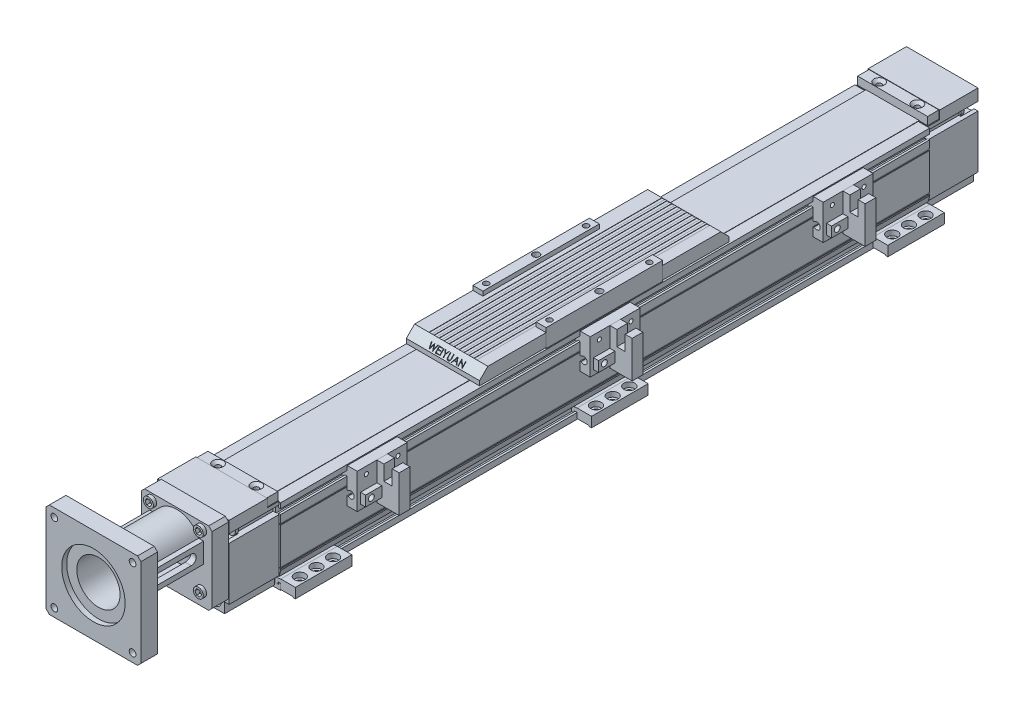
SolidWorks part; units mm, degrees
other "<感应开宽座>-<M3 螺纹孔1>"
other "<EE-SX672672P>-<凸台-拉伸3>"
other "<感应开宽座>-<M3 螺纹孔1>"
other "<EE-SX672672P>-<凸台-拉伸3>"
other "<感应开宽座>-<M3 螺纹孔1>"
other "<EE-SX672672P>-<凸台-拉伸3>"
ref_plane "前视基准面" through (0, 0, 0) normal (0, 0, 1) x (1, 0, 0)
ref_plane "上视基准面" through (0, 0, 0) normal (0, 1, 0) x (1, 0, 0)
ref_plane "右视基准面" through (0, 0, 0) normal (1, 0, 0) x (0, 0, -1)
sketch "草图1" plane through (0, 0, 0) normal (0, 0, 1) x (1, 0, 0)
  line L0 (-70.2256, 0) -> (70.2256, 0) construction
  line L1 (0, -59.1882) -> (0, 59.1882) construction
  line L2 (-22.5, -22.8) -> (-22.5, -19.3)
  line L3 (-22.5, 22.8) -> (-15, 22.8)
  line L4 (-22.5, -22.8) -> (-10, -22.8)
  line L5 (22.5, 19.7) -> (22.5, 22.8)
  line L6 (-15, 22.8) -> (-15, 21.3)
  line L7 (-15, 21.3) -> (-13, 21.3)
  line L8 (-13, 21.3) -> (-13, 22.8)
  line L9 (-12, 16.8) -> (12, 16.8)
  line L10 (-21.2, 16.7) -> (-22.5, 16.7)
  line L11 (12, 22.8) -> (12, 16.8)
  line L12 (13, 22.8) -> (12, 22.8)
  line L13 (-13, 22.8) -> (-12, 22.8)
  line L14 (-12, 22.8) -> (-12, 16.8)
  line L15 (-21.2, 16.7) -> (-21.2, 15.7)
  line L16 (-22.5, 12.2) -> (-22, 12.2)
  line L17 (-22, 12.2) -> (-22, 11.2)
  line L18 (13, 21.3) -> (13, 22.8)
  line L19 (15, 21.3) -> (13, 21.3)
  line L20 (15, 22.8) -> (15, 21.3)
  line L21 (22.5, 22.8) -> (15, 22.8)
  line L22 (-22.5, -19.3) -> (-21.2, -19.3)
  line L23 (-21.2, -19.3) -> (-21.2, -20.3)
  line L24 (-21.2, -20.3) -> (-19.3, -20.3)
  line L25 (-19.3, -20.3) -> (-19.3, -16.1)
  line L26 (-19.3, -16.1) -> (-21.5, -16.1)
  line L27 (-22.5, 19.7) -> (-21.2, 19.7)
  line L28 (-21.2, 19.7) -> (-21.2, 20.7)
  line L29 (-21.2, 20.7) -> (-19.3, 20.7)
  line L30 (-19.3, 20.7) -> (-19.3, 16.7)
  line L31 (-22, 11.2) -> (-22.5, 11.2)
  line L32 (-22.5, -12.37) -> (-22.5, -11.6)
  line L33 (-22.5, 19.7) -> (-22.5, 22.8)
  line L34 (21.2, 16.7) -> (22.5, 16.7)
  line L35 (19.3, 18.7) -> (23.7673, 18.7) construction
  line L36 (-21.2, 15.7) -> (-19.3, 15.7)
  line L37 (22.5, 12.2) -> (22.5, 16.7)
  line L38 (22, 12.2) -> (22, 11.2)
  line L39 (19.3, 20.7) -> (19.3, 16.7)
  line L40 (19.3, -18.2) -> (25.1099, -18.2) construction
  line L41 (22, 11.2) -> (22.5, 11.2)
  line L42 (22.5, -10.6) -> (22.5, 11.2)
  line L43 (22.5, -10.6) -> (22, -10.6)
  line L44 (19.3, -20.3) -> (19.3, -16.1)
  line L45 (22.5, -22.8) -> (22.5, -19.3)
  line L46 (-22.5, 12.2) -> (-22.5, 16.7)
  line L47 (-21.5, -16.1) -> (-22.5, -12.37)
  line L48 (-22.5, -10.6) -> (-22, -10.6)
  line L49 (-22, -10.6) -> (-22, -11.6)
  line L50 (-19.3, 18.7) -> (-23.7673, 18.7) construction
  line L51 (-22, -11.6) -> (-22.5, -11.6)
  line L52 (-22.5, -10.6) -> (-22.5, 11.2)
  line L53 (21.2, 20.7) -> (19.3, 20.7)
  line L54 (21.2, 19.7) -> (21.2, 20.7)
  line L55 (22.5, 19.7) -> (21.2, 19.7)
  line L56 (-19.3, -18.2) -> (-25.1099, -18.2) construction
  line L57 (22, -10.6) -> (22, -11.6)
  line L58 (22, -11.6) -> (22.5, -11.6)
  line L59 (21.2, -20.3) -> (19.3, -20.3)
  line L60 (21.2, -19.3) -> (21.2, -20.3)
  line L61 (22.5, -19.3) -> (21.2, -19.3)
  line L62 (22.5, -12.37) -> (22.5, -11.6)
  line L63 (21.5, -16.1) -> (22.5, -12.37)
  line L64 (19.3, -16.1) -> (21.5, -16.1)
  line L65 (22, 12.2) -> (22.5, 12.2)
  line L66 (10, -22.8) -> (22.5, -22.8)
  line L67 (-10, -22.3) -> (10, -22.3)
  line L68 (-10, -22.3) -> (-10, -22.8)
  line L69 (-19.3, 15.7) -> (-19.3, 16.7)
  line L70 (10, -22.3) -> (10, -22.8)
  line L71 (19.3, 16.7) -> (19.3, 15.7)
  line L72 (19.3, 15.7) -> (21.2, 15.7)
  line L73 (21.2, 15.7) -> (21.2, 16.7)
  circle A0 centre (-16, 18.2) radius 1.7
  circle A1 centre (-13, -16.8) radius 1.7
  circle A2 centre (16, 18.2) radius 1.7
  circle A3 centre (13, -16.8) radius 1.7
  point P6 (0, 0)
  point P9 (22.5, 0)
  point P11 (-22.5, 0)
  point P12 (0, -22.8)
  point P16 (0, -17.3)
  point P67 (20, 0)
  point P68 (-20, 0)
  dimension "D10" = 3.4
  dimension "D11" = 3.4
  dimension "D1" = 45
  dimension "D2" = 45.6
  dimension "D3" = 1
  dimension "D4" = 2
  dimension "D5" = 1.5
  dimension "D6" = 24
  dimension "D7" = 1
  dimension "D8" = 3
  dimension "D9" = 4.5
  dimension "D12" = 4.6
  dimension "D13" = 6
  dimension "D14" = 3.5
  dimension "D15" = 1
  dimension "D16" = 1.9
  dimension "D17" = 1.3
  dimension "D18" = 4.2
  dimension "D19" = 3.1
  dimension "D20" = 1.3
  dimension "D21" = 1
  dimension "D22" = 1.9
  dimension "D23" = 4
  dimension "D24" = 32
  dimension "D25" = 26
  dimension "D26" = 0.5
  dimension "D27" = 1
  dimension "D28" = 6
  dimension "D29" = 2.2
  dimension "D30" = 3.73
  dimension "D31" = 4.5
  dimension "D32" = 0.5
  dimension "D33" = 1
  dimension "D34" = 20
  dimension "D35" = 0.5
  dimension "D36" = 12.5
  dimension "D37" = 1
extrude "拉伸1" add sketch "草图1" along normal blind 390
sketch "草图2" plane through (0, 0, 390) normal (0, 0, 1) x (1, 0, 0)
  line L0 (-16, 18.2) -> (16, 18.2) construction
  line L1 (-13, -16.8) -> (13, -16.8) construction
  line L2 (0, 18.2) -> (0, 0) construction
  line L3 (18.8, -21.8) -> (-18.8, -21.8)
  line L4 (21.5, 28.2) -> (-21.5, 28.2)
  line L5 (-21.5, 28.2) -> (-21.5, 21.2)
  line L6 (-21.5, 21.2) -> (-18, 21.2)
  line L7 (-18, 21.2) -> (-18, 16.2)
  line L8 (-18, 16.2) -> (-21.5, 16.2)
  line L9 (-21.5, 16.2) -> (-21.5, -15.6)
  line L10 (-21.5, -15.6) -> (-18.8, -15.6)
  line L11 (-18.8, -15.6) -> (-18.8, -21.8)
  line L12 (21.5, -21.8) -> (-21.5, -21.8) construction
  line L16 (18.8, -15.6) -> (18.8, -21.8)
  line L17 (21.5, -15.6) -> (18.8, -15.6)
  line L18 (21.5, 16.2) -> (21.5, -15.6)
  line L19 (18, 16.2) -> (21.5, 16.2)
  line L20 (18, 21.2) -> (18, 16.2)
  line L21 (21.5, 21.2) -> (18, 21.2)
  line L22 (21.5, 28.2) -> (21.5, 21.2)
  circle A0 centre (-16, 18.2) radius 1.7
  circle A1 centre (-13, -16.8) radius 1.7
  circle A2 centre (16, 18.2) radius 1.7
  circle A3 centre (13, -16.8) radius 1.7
  point P18 (0, -21.8)
  dimension "D1" = 40
  dimension "D3" = 43
  dimension "D4" = 2
  dimension "D5" = 6.2
  dimension "D6" = 5.8
  dimension "D7" = 7
  dimension "D8" = 5
  dimension "D2" = 50
extrude "拉伸2" add sketch "草图2" along normal blind 30
sketch "草图3" plane through (0, 0, 420) normal (0, 0, 1) x (1, 0, 0)
  line L0 (0, 0) -> (0, 30.1742) construction
  circle A0 centre (-16, 18.2) radius 3.75
  circle A1 centre (-13, -16.8) radius 3.75
  circle A2 centre (16, 18.2) radius 3.75
  circle A3 centre (13, -16.8) radius 3.75
  dimension "D1" = 7.5
  dimension "D2" = 7.5
extrude "拉伸3" cut sketch "草图3" against normal blind 8
sketch "草图5" plane through (0, 0, 412) normal (0, 0, 1) x (1, 0, 0)
  line L0 (0, 0) -> (0, 9.7659) construction
  line L1 (13.866, -15.3) -> (14.7321, -16.8)
  line L2 (-14.2679, 18.2) -> (-15.134, 19.7)
  line L3 (-15.134, 19.7) -> (-16.866, 19.7)
  line L4 (-16.866, 19.7) -> (-17.7321, 18.2)
  line L5 (-17.7321, 18.2) -> (-16.866, 16.7)
  line L6 (-16.866, 16.7) -> (-15.134, 16.7)
  line L7 (-15.134, 16.7) -> (-14.2679, 18.2)
  line L8 (-14.7321, -16.8) -> (-13.866, -18.3)
  line L9 (-13.866, -18.3) -> (-12.134, -18.3)
  line L10 (-12.134, -18.3) -> (-11.2679, -16.8)
  line L11 (-11.2679, -16.8) -> (-12.134, -15.3)
  line L12 (-12.134, -15.3) -> (-13.866, -15.3)
  line L13 (-13.866, -15.3) -> (-14.7321, -16.8)
  line L14 (12.134, -15.3) -> (13.866, -15.3)
  line L15 (11.2679, -16.8) -> (12.134, -15.3)
  line L16 (12.134, -18.3) -> (11.2679, -16.8)
  line L17 (13.866, -18.3) -> (12.134, -18.3)
  line L18 (14.7321, -16.8) -> (13.866, -18.3)
  line L19 (15.134, 16.7) -> (14.2679, 18.2)
  line L20 (16.866, 16.7) -> (15.134, 16.7)
  line L21 (17.7321, 18.2) -> (16.866, 16.7)
  line L22 (16.866, 19.7) -> (17.7321, 18.2)
  line L23 (15.134, 19.7) -> (16.866, 19.7)
  line L24 (14.2679, 18.2) -> (15.134, 19.7)
  circle A0 centre (-16, 18.2) radius 3.25
  circle A1 centre (-16, 18.2) radius 1.5 construction
  circle A2 centre (-13, -16.8) radius 3.25
  circle A3 centre (-13, -16.8) radius 1.5 construction
  circle A4 centre (13, -16.8) radius 1.5 construction
  circle A5 centre (16, 18.2) radius 1.5 construction
  circle A6 centre (13, -16.8) radius 3.25
  circle A7 centre (16, 18.2) radius 3.25
  dimension "D1" = 6.5
  dimension "D2" = 3
  dimension "D3" = 6.5
  dimension "D4" = 3
extrude "拉伸4" add sketch "草图5" along normal blind 2
sketch "草图6" plane through (0, 28.2, 0) normal (0, 1, 0) x (1, 0, 0)
  line L0 (21.5, -420) -> (21.5, -390) construction
  line L1 (-21.5, -390) -> (21.5, -390)
  line L2 (-21.5, -390) -> (-21.5, -397)
  line L3 (-21.5, -397) -> (21.5, -397)
  line L4 (21.5, -390) -> (21.5, -397)
  dimension "D1" = 7
extrude "拉伸5" cut sketch "草图6" against normal blind 5
sketch "草图7" plane through (0, -22.8, 0) normal (0, -1, 0) x (1, 0, 0)
  line L0 (0, 0) -> (0, 390) construction
  line L1 (-10, 390) -> (10, 390) construction
  point P5 (0, 195)
ref_plane "基准面1" through (0, 0, 195) normal (0, 0, 1) x (1, 0, 0)
mirror "镜向2" about plane through (0, 0, 195) normal (0, 0, 1)
sketch "草图8" plane through (0, 23.2, 0) normal (0, 1, 0) x (1, 0, 0)
  line L0 (0, 7) -> (0, -8.336) construction
  line L1 (-21.5, 7) -> (21.5, 7) construction
  line L2 (-16, 7) -> (-16, -397)
  line L3 (-21.5, -397) -> (21.5, -397) construction
  line L4 (16, 7) -> (16, -397)
  line L5 (-16, 7) -> (16, 7)
  line L6 (-16, -397) -> (16, -397)
  dimension "D1" = 32
extrude "拉伸6" add sketch "草图8" along normal blind 0.2
sketch "草图9" plane through (0, 23.2, 0) normal (0, 1, 0) x (1, 0, 0)
  line L0 (0, 0) -> (0, 7) construction
  line L2 (-21.5, 7) -> (21.5, 7) construction
  line L4 (-21, 7) -> (-21, 0.2)
  line L6 (-21, 0.2) -> (21, 0.2)
  line L7 (-21, 7) -> (21, 7)
  line L9 (21, 7) -> (21, 0.2)
  line L10 (-18.8, 0) -> (18.8, 0) construction
  dimension "D1" = 42
  dimension "D2" = 0.2
extrude "拉伸7" add sketch "草图9" along normal blind 4.8
sketch "草图10" plane through (0, 28, 0) normal (0, 1, 0) x (1, 0, 0)
  line L0 (0, 7) -> (0, 0.2) construction
  line L1 (-21.5, 7) -> (21.5, 7) construction
  line L2 (-21, 0.2) -> (21, 0.2) construction
  line L3 (-21, 3.6) -> (21, 3.6) construction
  line L4 (-21, 7) -> (-21, 0.2) construction
  line L5 (21, 0.2) -> (21, 7) construction
  line L6 (-11.5, 3.6) -> (-11.5, 5.6128) construction
  line L7 (11.5, 3.6) -> (11.5, 5.6128) construction
  dimension "D1" = 23
hole_wizard "打孔尺寸根据十字槽沉头自攻螺钉的类型1" positions "3D草图1" profile "草图11" countersink size "ST2.9" standard "GB"
sketch3d "3D草图1"
  point P0 (-11.5, 28, -3.6)
  point P3 (11.5, 28, -3.6)
sketch "草图11" plane through (-11.5, 28, -3.6) normal (1, 0, 0) x (0, 0, 1)
  line L0 (0, 0) -> (0, 5.7313)
  line L1 (0, 5.7313) -> (1.55, 4.8)
  line L2 (1.55, 4.8) -> (1.55, 1.6)
  line L3 (1.55, 1.6) -> (3.15, 0)
  line L5 (3.15, 0) -> (0, 0)
  line L6 (-1.55, 1.6) -> (-3.15, 0) construction
  line L10 (0, 5.7313) -> (-1.55, 4.8) construction
  line L11 (0, -6.35) -> (0, 107.95) construction
  dimension "孔直径" = 3.1
  dimension "孔深度" = 4.8
  dimension "近端锥形沉头孔直径" = 6.3
  dimension "近端锥形沉头孔角度" = 90
  dimension "导头角度" = 118
mirror "镜向3" about plane through (0, 0, 195) normal (0, 0, 1)
sketch "草图12" plane through (0, 0, 420) normal (0, 0, 1) x (1, 0, 0)
  line L0 (0, 28.2) -> (0, -21.8) construction
  line L1 (21.5, 28.2) -> (-21.5, 28.2) construction
  line L2 (-18.8, -21.8) -> (18.8, -21.8) construction
  line L3 (15, 25.2) -> (-15, 25.2) construction
  line L4 (15, 9.2) -> (-15, 9.2) construction
  circle A0 centre (-15, 25.2) radius 2
  circle A1 centre (15, 25.2) radius 2
  circle A2 centre (15, -6.8) radius 2
  circle A3 centre (-15, -6.8) radius 2
  point P9 (0, 25.2)
  dimension "D4" = 4
  dimension "D1" = 3
  dimension "D2" = 30
  dimension "D3" = 16
extrude "拉伸8" cut sketch "草图12" against normal blind 8
sketch "草图13" plane through (0, 0, 420) normal (0, 0, 1) x (1, 0, 0)
  line L0 (-15, 25.2) -> (15, 25.2) construction
  line L1 (-15, 25.2) -> (-15, -6.8) construction
  line L2 (-15, -6.8) -> (15, -6.8) construction
  line L3 (15, -6.8) -> (15, 25.2) construction
  line L4 (0, 25.2) -> (0, -6.8) construction
  line L5 (-15, 9.2) -> (15, 9.2) construction
  line L6 (-21.25, 29.2) -> (-21.25, -14.8)
  line L7 (21.25, 29.2) -> (21.25, -14.8)
  line L8 (-21.25, 29.2) -> (21.25, 29.2)
  line L9 (-21.25, -14.8) -> (21.25, -14.8)
  circle A0 centre (-15, 25.2) radius 2
  circle A1 centre (15, 25.2) radius 2
  circle A2 centre (15, -6.8) radius 2
  circle A3 centre (-15, -6.8) radius 2
  dimension "D1" = 42.5
  dimension "D2" = 4
  dimension "D3" = 44
extrude "拉伸9" add sketch "草图13" along normal blind 10
sketch "草图14" plane through (0, 0, 430) normal (0, 0, 1) x (1, 0, 0)
  line L0 (0, 29.2) -> (0, 13.7) construction
  line L1 (21.25, 29.2) -> (-21.25, 29.2) construction
  line L2 (0, 13.7) -> (16.2, 13.7) construction
  line L3 (16.2, 19.7) -> (16.2, 7.7)
  line L4 (16.2, 7.7) -> (13.2004, 7.7)
  line L5 (16.2, 19.7) -> (13.2004, 19.7)
  line L6 (-16.2, 19.7) -> (-13.2004, 19.7)
  line L7 (-16.2, 7.7) -> (-13.2004, 7.7)
  line L8 (-16.2, 19.7) -> (-16.2, 7.7)
  arc A0 (13.2004, 19.7) -> (-13.2004, 19.7) centre (0, 13.7) ccw
  arc A1 (-13.2004, 7.7) -> (13.2004, 7.7) centre (0, 13.7) ccw
  circle A2 centre (0, 13.7) radius 13
  dimension "D2" = 29
  dimension "D5" = 26
  dimension "D1" = 15.5
  dimension "D3" = 16.2
  dimension "D4" = 12
extrude "拉伸10" add sketch "草图14" along normal blind 40
sketch "草图15" plane through (16.2, 0, 0) normal (1, 0, 0) x (0, 0, -1)
  line L0 (-470, 13.7) -> (-430, 13.7) construction
  line L1 (-470, 7.7) -> (-470, 19.7) construction
  line L2 (-430, 7.7) -> (-430, 19.7) construction
  line L3 (-450, 19.7) -> (-450, 7.7) construction
  line L4 (-470, 19.7) -> (-430, 19.7) construction
  line L5 (-470, 7.7) -> (-430, 7.7) construction
  line L6 (-462.5, 16.7) -> (-437.5, 16.7)
  line L7 (-462.5, 10.7) -> (-437.5, 10.7)
  arc A0 (-462.5, 16.7) -> (-462.5, 10.7) centre (-462.5, 13.7) ccw
  arc A1 (-437.5, 16.7) -> (-437.5, 10.7) centre (-437.5, 13.7) cw
  dimension "D1" = 6
  dimension "D2" = 25
extrude "拉伸11" cut sketch "草图15" against normal blind 8
sketch "草图16" plane through (0, 0, 470) normal (0, 0, 1) x (1, 0, 0)
  line L0 (-30.6325, 13.7) -> (30.6325, 13.7) construction
  line L1 (0, -8.6267) -> (0, 36.0267) construction
  line L2 (28.5, 42.2) -> (-28.5, 42.2)
  line L3 (-28.5, 42.2) -> (-28.5, -14.8)
  line L4 (28.5, 42.2) -> (28.5, -14.8)
  line L5 (28.5, -14.8) -> (-28.5, -14.8)
  circle A0 centre (-23.5, 37.2) radius 2
  circle A1 centre (23.5, 37.2) radius 2
  circle A2 centre (23.5, -9.8) radius 2
  circle A3 centre (-23.5, -9.8) radius 2
  point P7 (0, 13.7)
  point P10 (0, -14.8)
  point P12 (0, 42.2)
  point P13 (28.5, 13.7)
  point P14 (-28.5, 13.7)
  dimension "D3" = 4
  dimension "D1" = 57
  dimension "D2" = 57
  dimension "D4" = 47
  dimension "D5" = 47
extrude "拉伸12" add sketch "草图16" along normal blind 10
sketch "草图20" plane through (0, 0, 430) normal (0, 0, 1) x (1, 0, 0)
  line L0 (0, 0) -> (0, 18.1432) construction
  line L1 (17, 25.2) -> (16, 26.9321)
  line L2 (16, 26.9321) -> (14, 26.9321)
  line L3 (14, 26.9321) -> (13, 25.2)
  line L4 (13, 25.2) -> (14, 23.4679)
  line L5 (14, 23.4679) -> (16, 23.4679)
  line L6 (16, 23.4679) -> (17, 25.2)
  line L7 (17, -6.8) -> (16, -5.0679)
  line L8 (16, -5.0679) -> (14, -5.0679)
  line L9 (14, -5.0679) -> (13, -6.8)
  line L10 (13, -6.8) -> (14, -8.5321)
  line L11 (14, -8.5321) -> (16, -8.5321)
  line L12 (16, -8.5321) -> (17, -6.8)
  line L13 (-16, -8.5321) -> (-17, -6.8)
  line L14 (-14, -8.5321) -> (-16, -8.5321)
  line L15 (-13, -6.8) -> (-14, -8.5321)
  line L16 (-14, -5.0679) -> (-13, -6.8)
  line L17 (-16, -5.0679) -> (-14, -5.0679)
  line L18 (-17, -6.8) -> (-16, -5.0679)
  line L19 (-16, 23.4679) -> (-17, 25.2)
  line L20 (-14, 23.4679) -> (-16, 23.4679)
  line L21 (-13, 25.2) -> (-14, 23.4679)
  line L22 (-14, 26.9321) -> (-13, 25.2)
  line L23 (-16, 26.9321) -> (-14, 26.9321)
  line L24 (-17, 25.2) -> (-16, 26.9321)
  circle A0 centre (15, 25.2) radius 3
  circle A1 centre (15, 25.2) radius 1.7321 construction
  circle A2 centre (15, -6.8) radius 3
  circle A3 centre (15, -6.8) radius 1.7321 construction
  circle A4 centre (-15, -6.8) radius 1.7321 construction
  circle A5 centre (-15, 25.2) radius 1.7321 construction
  circle A6 centre (-15, -6.8) radius 3
  circle A7 centre (-15, 25.2) radius 3
  dimension "D1" = 6
  dimension "D2" = 6
extrude "拉伸15" add sketch "草图20" along normal blind 2
sketch "草图23" plane through (0, 22.8, 0) normal (0, 1, 0) x (1, 0, 0)
  line L0 (-22.5, -195) -> (22.5, -195) construction
  line L1 (-22.5, -390) -> (-22.5, 0) construction
  line L2 (22.5, -390) -> (22.5, 0) construction
  line L3 (0, -390.2) -> (0, 0.2) construction
  line L4 (-21, -390.2) -> (21, -390.2) construction
  line L5 (-21, 0.2) -> (21, 0.2) construction
  line L6 (-22, -230) -> (-22, -160)
  line L7 (-22, -160) -> (-16, -160)
  line L8 (-22, -230) -> (-16, -230)
  line L9 (22, -230) -> (22, -160)
  line L10 (-16, -160) -> (-16, -230)
  line L11 (16, -160) -> (16, -230)
  line L12 (16, -160) -> (22, -160)
  line L13 (16, -230) -> (22, -230)
  point P15 (22, -195)
  point P17 (-22, -195)
  point P18 (0, -305)
  point P19 (0, -85)
  dimension "D1" = 70
  dimension "D2" = 44
  dimension "D3" = 32
extrude "拉伸18" add sketch "草图23" along normal blind 10.9
sketch "草图32" plane through (0, 23.4, 0) normal (0, 1, 0) x (1, 0, 0)
  line L0 (-22, -160) -> (-22, -120)
  line L1 (-22, -120) -> (22, -120)
  line L2 (-16, -195) -> (16, -195) construction
  line L3 (-16, -230) -> (-16, -160) construction
  line L4 (16, -160) -> (16, -230) construction
  line L5 (0, -120) -> (0, -270) construction
  line L6 (-22, -160) -> (-16, -160)
  line L7 (-16, -160) -> (-16, -230)
  line L8 (16, -160) -> (16, -230)
  line L9 (22, -160) -> (16, -160)
  line L10 (22, -160) -> (22, -120)
  line L11 (-22, -160) -> (-22, -120)
  line L12 (-22, -160) -> (-16, -160)
  line L13 (-16, -160) -> (-16, -230)
  line L14 (16, -160) -> (16, -230)
  line L15 (22, -160) -> (16, -160)
  line L16 (22, -160) -> (22, -120)
  line L17 (22, -230) -> (22, -270)
  line L18 (22, -230) -> (16, -230)
  line L19 (-22, -230) -> (-16, -230)
  line L20 (-22, -230) -> (-22, -270)
  line L21 (22, -230) -> (22, -270)
  line L22 (22, -230) -> (16, -230)
  line L23 (-22, -230) -> (-16, -230)
  line L24 (-22, -270) -> (22, -270)
  line L25 (-22, -230) -> (-22, -270)
  point P17 (0, -195)
  dimension "D1" = 75
extrude "凸台-拉伸2" add sketch "草图32" along normal blind 7.7 separate body contours L0 L6 L1 M6 | L24 L1 M8 M2 M3 M4 M6 M7 | L9 L10 L1 M4 | L24 L17 L18 M2 | L20 L24 L19 M8
chamfer "倒角1" distance 5 angle 45 2 edges at (0, 31.1, 120) (0, 31.1, 270)
sketch "草图33" plane through (0, 0, 420) normal (0, 0, 1) x (1, 0, 0)
  line L0 (0, -22.3) -> (0, 13.6) construction
  line L1 (-10, -22.3) -> (10, -22.3) construction
  line L2 (10, -22.8) -> (22.5, -22.8) construction
  circle A0 centre (0, 13.6) radius 3
  dimension "D2" = 6
  dimension "D1" = 36.4
extrude "凸台-拉伸3" add sketch "草图33" along normal blind 24
sketch "草图35" plane through (0, 33.7, 0) normal (0, 1, 0) x (1, 0, 0)
  line L0 (-19, -165) -> (-19, -225) construction
  line L1 (-19, -225) -> (19, -225) construction
  line L2 (19, -225) -> (19, -165) construction
  line L3 (19, -165) -> (-19, -165) construction
  line L4 (0, -225) -> (0, -390.2) construction
  line L5 (-16, -390.2) -> (16, -390.2) construction
  line L6 (22, -195) -> (19, -195) construction
  line L7 (22, -230) -> (22, -160) construction
  line L8 (19, -195) -> (-19, -195) construction
  dimension "D1" = 38
  dimension "D2" = 60
hole_wizard "M4 螺纹孔1" positions "3D草图2" profile "草图36" tap size "M4" standard "GB"
sketch3d "3D草图2"
  point P0 (-19, 33.7, 165)
  point P3 (-19, 33.7, 225)
  point P6 (19, 33.7, 225)
  point P9 (19, 33.7, 165)
sketch "草图36" plane through (-19, 33.7, 165) normal (1, 0, 0) x (0, 0, 1)
  line L0 (0, 0) -> (0, 12.4914)
  line L1 (0, 12.4914) -> (1.65, 11.5)
  line L2 (1.65, 11.5) -> (1.65, 0)
  line L5 (1.65, 0) -> (0, 0)
  line L10 (0, 12.4914) -> (-1.65, 11.5) construction
  line L11 (0, -6.35) -> (0, 107.95) construction
  dimension "螺纹孔钻头直径" = 3.3
  dimension "螺纹孔钻头深度" = 11.5
  dimension "导头角度" = 118
sketch "草图37" plane through (0, 33.7, 0) normal (0, 1, 0) x (1, 0, 0)
  circle A0 centre (-19, -195) radius 2
  circle A1 centre (19, -195) radius 2
  dimension "D1" = 4
  dimension "D2" = 4
extrude "切除-拉伸2" cut sketch "草图37" against normal blind 8
ref_plane "基准面3" through (0, 0, 195) normal (0, 0, 1) x (1, 0, 0)
inserted part "感应开宽座"
move or copy body "实体-移动/复制2" placed by mates yes
other "距离1" parameters "D1"=15
inserted part "EE-SX672672P"
move or copy body "实体-移动/复制4" placed by mates yes
inserted part "感应开宽座2"
move or copy body "实体-移动/复制6" placed by mates yes
other "距离2" parameters "D1"=110
inserted part "EE-SX672672P2"
move or copy body "实体-移动/复制8" placed by mates yes
inserted part "感应开宽座3"
move or copy body "实体-移动/复制10" placed by mates yes
other "距离3" parameters "D1"=110
inserted part "EE-SX672672P3"
move or copy body "实体-移动/复制12" placed by mates yes
sketch "草图49" plane through (0, 0, 390) normal (0, 0, 1) x (1, 0, 0)
  line L0 (31.3, -22.8) -> (29.8, -22.8)
  line L1 (29.8, -22.3) -> (22.5, -22.3)
  line L2 (19.3, -17.3) -> (22.57, -16.8)
  line L3 (20.8, -20.3) -> (19.3, -20.3)
  line L4 (22.5, -19.1) -> (20.8, -19.1)
  line L5 (22.57, -16.8) -> (31.3, -16.8)
  line L6 (19.3, -20.3) -> (19.3, -17.3)
  line L7 (20.8, -19.1) -> (20.8, -20.3)
  line L9 (22.5, -22.3) -> (22.5, -19.1)
  line L10 (29.8, -22.8) -> (29.8, -22.3)
  line L11 (31.3, -16.8) -> (31.3, -22.8)
  line L12 (10, -22.8) -> (22.5, -22.8) construction
extrude "凸台-拉伸5" add sketch "草图49" against normal blind 34 separate body
hole_wizard "M3 六角头螺栓的柱形沉头孔1" positions "草图51" profile "草图50" counterbore size "M3" standard "Gb"
sketch "草图51" plane through (0, -16.8, 0) normal (0, 1, 0) x (1, 0, 0)
  line L0 (31.3, -373) -> (22.57, -373) construction
  line L1 (31.3, -356) -> (31.3, -390) construction
  line L2 (22.57, -356) -> (22.57, -390) construction
  point P0 (27, -363)
  point P2 (27, -373)
  point P4 (27, -383)
  dimension "D1" = 20
  dimension "D2" = 4.3
sketch "草图50" plane through (27, -16.8, 363) normal (1, 0, 0) x (0, 0, 1)
  line L0 (0, 0) -> (0, 6)
  line L1 (0, 6) -> (1.75, 6)
  line L3 (1.75, 6) -> (1.75, 3)
  line L4 (1.75, 3) -> (3.25, 3)
  line L5 (3.25, 3) -> (3.25, 0)
  line L7 (3.25, 0) -> (0, 0)
  line L11 (0, -6.35) -> (0, 107.95) construction
  dimension "通孔孔直径" = 3.5
  dimension "通孔孔深度" = 6
  dimension "柱形沉头孔直径" = 6.5
  dimension "柱形沉头孔深度" = 3
pattern_linear "阵列(线性)1" count 3 spacing 178 along (0, 0, -1) of "凸台-拉伸5", "M3 六角头螺栓的柱形沉头孔1"
sketch "草图61" plane through (0, 148.05, 148.05) normal (0, 0.7071, 0.7071) x (1, 0, 0)
  text T0 "WEIYUAN"
extrude "切除-拉伸5" cut sketch "草图61" against normal blind 1
mirror "镜向6" about plane through (0, 0, 0) normal (1, 0, 0) of "阵列(线性)1", "凸台-拉伸5", "M3 六角头螺栓的柱形沉头孔1"
sketch "草图62" plane through (0, 31.1, 0) normal (0, 1, 0) x (1, 0, 0)
  line L0 (22, -125) -> (-22, -125) construction
  line L1 (-13.4173, -125) -> (-11.6554, -125)
  line L2 (-13.4173, -125) -> (-13.4173, -265)
  line L3 (-13.4173, -265) -> (-11.6554, -265)
  line L4 (-11.6554, -125) -> (-11.6554, -265)
  line L5 (-22, -265) -> (22, -265) construction
extrude "切除-拉伸6" cut sketch "草图62" against normal blind 0.2
pattern_linear "阵列(线性)2" count 10 spacing 3 along (1, 0, 0) of "切除-拉伸6"
sketch "草图63" plane through (0, 0, 480) normal (0, 0, 1) x (1, 0, 0)
  circle A0 centre (0, 13.7) radius 19.05
  dimension "D1" = 38.1
extrude "切除-拉伸7" cut sketch "草图63" against normal blind 3
sketch "草图64" plane through (0, 0, 477) normal (0, 0, 1) x (1, 0, 0)
  circle A0 centre (0, 13.7) radius 13
  dimension "D1" = 26
extrude "切除-拉伸8" cut sketch "草图64" against normal blind 47
sketch "草图65" plane through (0, 0, 430) normal (0, 0, 1) x (1, 0, 0)
  circle A0 centre (0, 13.7) radius 9.5
  dimension "D1" = 19
extrude "切除-拉伸9" cut sketch "草图65" against normal blind 10
sketch "草图67" plane through (0, 0, 420) normal (0, 0, 1) x (1, 0, 0)
  circle A0 centre (0, 13.7) radius 3
  dimension "D1" = 6
extrude "凸台-拉伸6" add sketch "草图67" along normal blind 24
chamfer "倒角2" distance 2 angle 45 8 edges at (28.5, -14.8, 475) (-28.5, -14.8, 475) (-28.5, 42.2, 475) (28.5, 42.2, 475) (-21.25, -14.8, 425) (-21.25, 29.2, 425) (21.25, -14.8, 425) (21.25, 29.2, 425)
